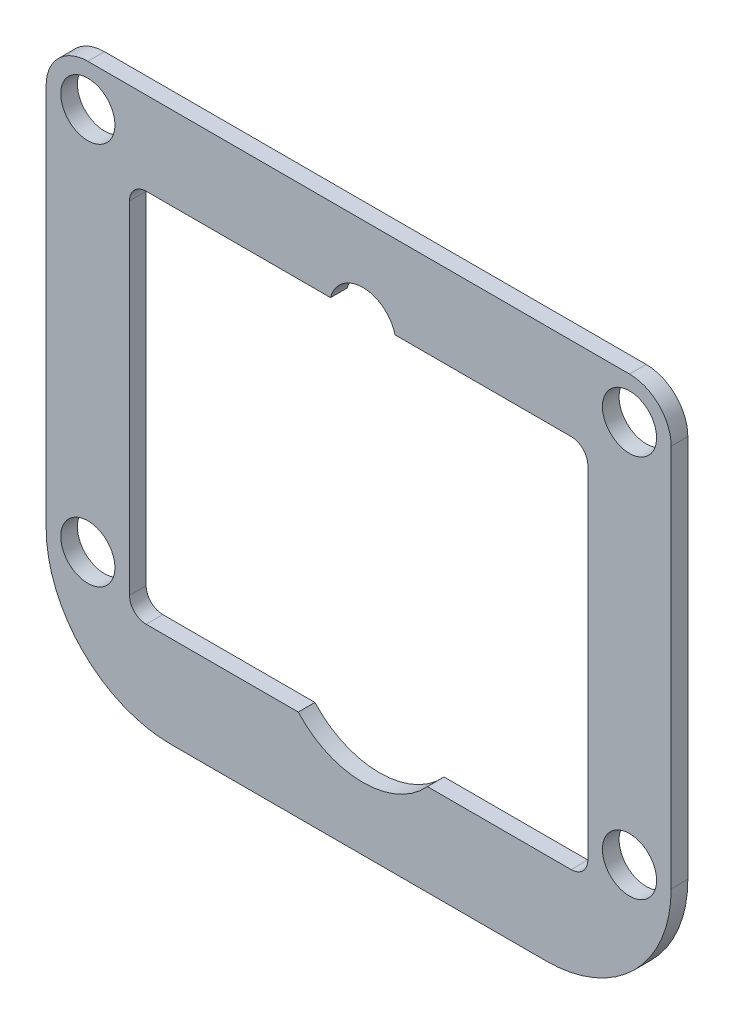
SolidWorks part; units mm, degrees
ref_plane "Plane1" through (0, 0, 0) normal (0, 0, 1) x (1, 0, 0)
ref_plane "Plane2" through (0, 0, 0) normal (0, 1, 0) x (1, 0, 0)
ref_plane "Plane3" through (0, 0, 0) normal (1, 0, 0) x (0, 0, -1)
sketch "Esquisse1" plane through (0, 0, 0) normal (0, 0, 1) x (1, 0, 0)
  line L0 (0, 0) -> (75, 0)
  line L1 (0, 0) -> (0, -66)
  line L2 (75, -66) -> (0, -66)
  line L3 (75, -66) -> (75, 0)
  dimension "D1" = 66
  dimension "D2" = 75
extrude "Base-Extrusion" add sketch "Esquisse1" along normal blind 2
fillet "Congé12" radius 15
fillet "Congé13" radius 15
sketch "Esquisse50" plane through (0, 0, 2) normal (0, 0, 1) x (1, 0, 0)
  line L0 (0, 0) -> (75, 0) construction
  line L1 (0, 0) -> (0, -51) construction
  line L4 (75, -51) -> (75, 0) construction
  line L5 (65, -10) -> (10, -10)
  line L7 (65, -10) -> (65, -55)
  line L9 (10, -55) -> (65, -55)
  line L10 (10, -55) -> (10, -10)
  line L11 (60, -66) -> (15, -66) construction
  circle A0 centre (5, -5) radius 3.25
  circle A1 centre (5, -51) radius 3.25
  circle A2 centre (70, -5) radius 3.25
  circle A3 centre (70, -51) radius 3.25
  dimension "D1" = 6.5
  dimension "D2" = 6.5
  dimension "D3" = 5
  dimension "D4" = 5
  dimension "D5" = 51
  dimension "D6" = 5
  dimension "D7" = 10
  dimension "D8" = 10
  dimension "D9" = 10
  dimension "D10" = 11
sketch "Esquisse53" plane through (0, 0, 2) normal (0, 0, 1) x (1, 0, 0)
  circle A0 centre (38, -48) radius 10.4403
extrude "Enlèv. mat.-Extru.3" cut sketch "Esquisse53" against normal blind 10
extrude "Enlèv. mat.-Extru.4" cut sketch "Esquisse50" against normal blind 10
sketch "Esquisse54" plane through (0, 0, 2) normal (0, 0, 1) x (1, 0, 0)
  circle A0 centre (38, -11) radius 4
extrude "Enlèv. mat.-Extru.5" cut sketch "Esquisse54" against normal blind 10
fillet "Congé15" radius 2
fillet "Congé16" radius 2
fillet "Congé17" radius 2
fillet "Congé18" radius 2
fillet "Congé19" radius 5
fillet "Congé20" radius 5
